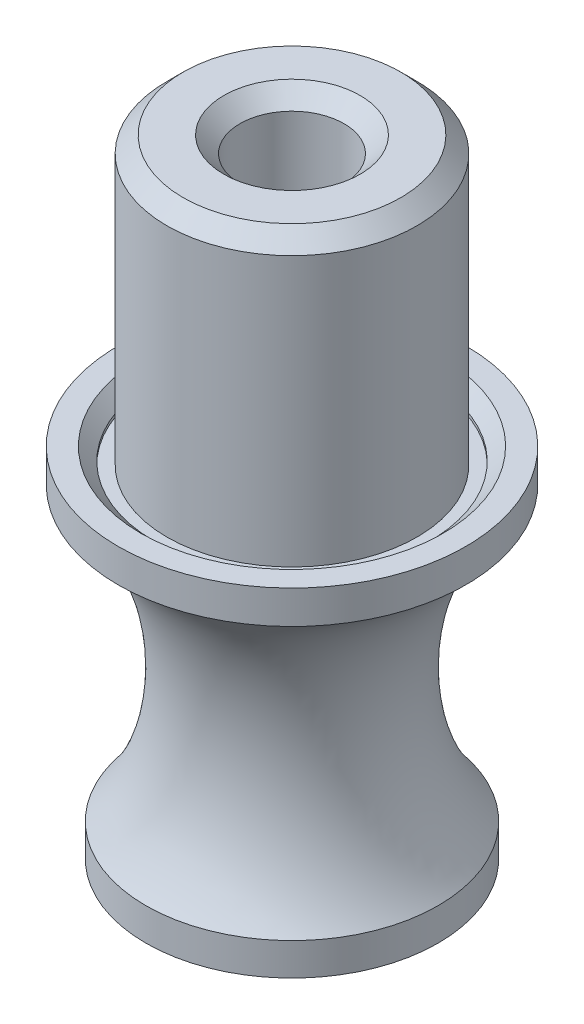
SolidWorks part; units mm, degrees
ref_plane "Plan de face" through (0, 0, 0) normal (0, 0, 1) x (1, 0, 0)
ref_plane "Plan de dessus" through (0, 0, 0) normal (0, 1, 0) x (1, 0, 0)
ref_plane "Plan de droite" through (0, 0, 0) normal (1, 0, 0) x (0, 0, -1)
sketch "Esquisse1" plane through (0, 0, 0) normal (0, 0, 1) x (1, 0, 0)
  line L0 (0, 41.6) -> (0, -56.6567) construction
  line L1 (-9.8567, 0) -> (18.8567, 0) construction
  line L2 (-8.6149, 11) -> (11.409, 11) construction
  line L3 (-13.8925, 19.3) -> (16.0657, 19.3) construction
  line L4 (1.6, 18.8) -> (1.6, 0.5)
  line L5 (3.85, 18.8) -> (3.85, 11)
  line L6 (3.85, 11) -> (3.85, 10.5)
  line L7 (2.1, 0) -> (4.5, 0)
  line L8 (5.35, 11) -> (5.35, 9.9748)
  line L9 (4.5, 0) -> (4.5, 1)
  line L10 (2.1, 19.3) -> (3.35, 19.3)
  line L11 (3.35, 19.3) -> (3.85, 18.8)
  line L12 (1.6, 0.5) -> (2.1, 0)
  line L13 (2.1, 19.3) -> (1.6, 18.8)
  line L14 (3.85, 10.5) -> (4.25, 10.5)
  line L15 (4.25, 10.5) -> (4.25, 10.6)
  line L16 (4.65, 11) -> (5.35, 11)
  line L17 (4.25, 10.6) -> (4.65, 11)
  spline S0 degree 3 poles (5.35, 9.9748) (3.1211, 8.9109) (2.2512, 3.739) (4.5, 1) knots 0 0 0 0 1 1 1 1
  point P9 (1.6, 19.3)
  point P10 (1.6, 0)
  point P11 (3.85, 19.3)
  point P26 (4.25, 11)
  dimension "D1" = 11
  dimension "D2" = 8.3
  dimension "D3" = 1.6
  dimension "D4" = 29.9582
  dimension "D5" = 3.85
  dimension "D6" = 1.5
  dimension "D7" = 4.5
  dimension "D8" = 0.4
  dimension "D9" = 1
  dimension "D10" = 0.5
revolve "Révolution1" add sketch "Esquisse1" angle 360 about L0
sketch "Esquisse2" plane through (0, 0, 0) normal (0, -1, 0) x (1, 0, 0)
  line L0 (-6.5663, 0) -> (7.4024, 0)
  line L1 (0, 5.8383) -> (0, -6.1411)
